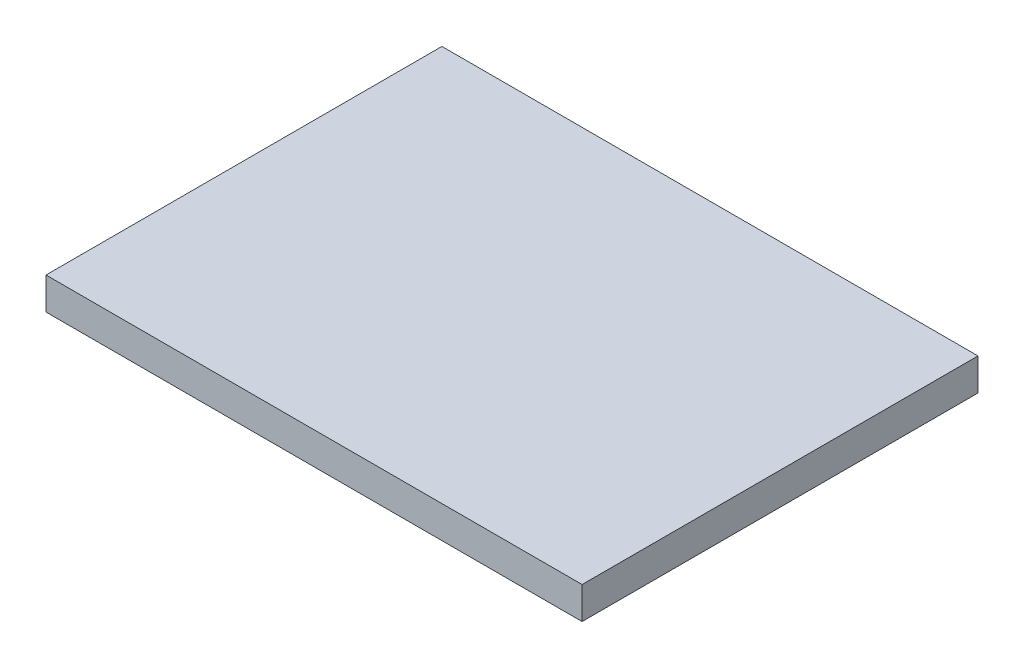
SolidWorks part; units mm, degrees
ref_plane "Ebene vorne" through (0, 0, 0) normal (0, 0, 1) x (1, 0, 0)
ref_plane "Ebene oben" through (0, 0, 0) normal (0, 1, 0) x (1, 0, 0)
ref_plane "Ebene rechts" through (0, 0, 0) normal (1, 0, 0) x (0, 0, -1)
sketch "Skizze2" plane through (0, 0, 0) normal (0, 1, 0) x (1, 0, 0)
  line L1 (-125.25, -92.5) -> (125.25, -92.5)
  line L2 (-125.25, -92.5) -> (-125.25, 92.5)
  line L3 (-125.25, 92.5) -> (125.25, 92.5)
  line L4 (125.25, -92.5) -> (125.25, 92.5)
  line L5 (-125.25, -92.5) -> (125.25, 92.5) construction
  line L6 (-125.25, 92.5) -> (125.25, -92.5) construction
  point P0 (0, 0)
  dimension "D1" = 185
  dimension "D2" = 250.5
extrude "Aufsatz-Linear austragen1" add sketch "Skizze2" along normal blind 15
